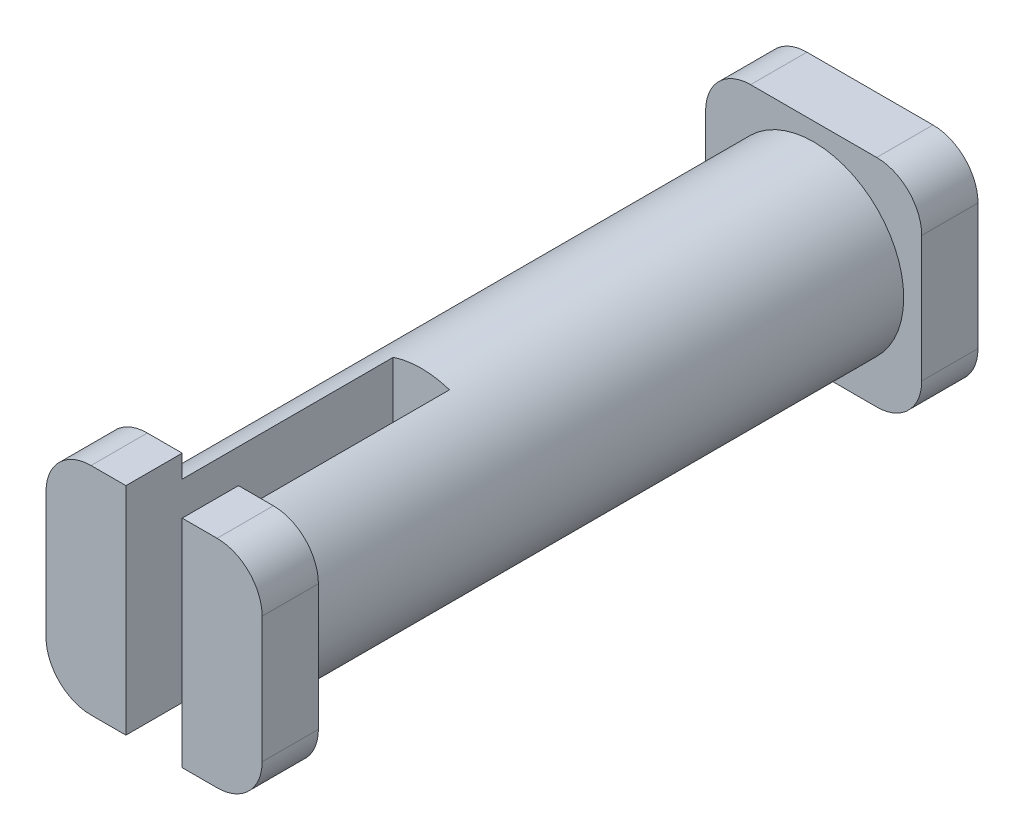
SolidWorks part; units mm, degrees
ref_plane "Front Plane" through (0, 0, 0) normal (0, 0, 1) x (1, 0, 0)
ref_plane "Top Plane" through (0, 0, 0) normal (0, 1, 0) x (1, 0, 0)
ref_plane "Right Plane" through (0, 0, 0) normal (1, 0, 0) x (0, 0, -1)
sketch "Sketch1" plane through (0, 0, 0) normal (0, 0, 1) x (1, 0, 0)
  line L1 (1.27, 0) -> (4.826, 0)
  line L2 (0, 1.27) -> (0, 4.826)
  line L3 (1.27, 6.096) -> (4.826, 6.096)
  line L4 (6.096, 1.27) -> (6.096, 4.826)
  arc A0 (4.826, 0) -> (6.096, 1.27) centre (4.826, 1.27) ccw
  arc A1 (1.27, 0) -> (0, 1.27) centre (1.27, 1.27) cw
  arc A2 (0, 4.826) -> (1.27, 6.096) centre (1.27, 4.826) cw
  arc A3 (4.826, 6.096) -> (6.096, 4.826) centre (4.826, 4.826) cw
  point P7 (6.096, 0)
  point P10 (0, 0)
  point P13 (0, 6.096)
  point P16 (6.096, 6.096)
  dimension "D3" = 1.27
  dimension "D1" = 6.096
  dimension "D2" = 6.096
extrude "Boss-Extrude1" add sketch "Sketch1" along normal blind 1.5875
sketch "Sketch2" plane through (0, 0, 1.5875) normal (0, 0, 1) x (1, 0, 0)
  line L0 (0, 4.826) -> (0, 1.27) construction
  line L1 (4.826, 6.096) -> (1.27, 6.096) construction
  circle A0 centre (3.048, 3.048) radius 2.54
  point P5 (0, 3.048)
  point P9 (3.048, 6.096)
  dimension "D1" = 5.08
extrude "Boss-Extrude2" add sketch "Sketch2" along normal blind 17.018
ref_plane "Plane1" through (0, 0, 10.0965) normal (0, 0, 1) x (1, 0, 0)
mirror "Mirror1" about plane through (0, 0, 10.0965) normal (0, 0, 1) of "Boss-Extrude1"
sketch "Sketch3" plane through (0, 0, 20.193) normal (0, 0, 1) x (1, 0, 0)
  line L0 (4.826, 6.096) -> (1.27, 6.096) construction
  line L1 (2.2543, 6.096) -> (3.8418, 6.096)
  line L2 (2.2543, 6.096) -> (2.2543, 0)
  line L3 (2.2543, 0) -> (3.8418, 0)
  line L4 (3.8418, 6.096) -> (3.8418, 0)
  line L5 (1.27, 0) -> (4.826, 0) construction
  line L6 (3.048, 0) -> (3.048, -0.924) construction
  point P12 (3.048, 0)
  dimension "D1" = 1.5875
extrude "Cut-Extrude1" cut sketch "Sketch3" against normal blind 7.5406
